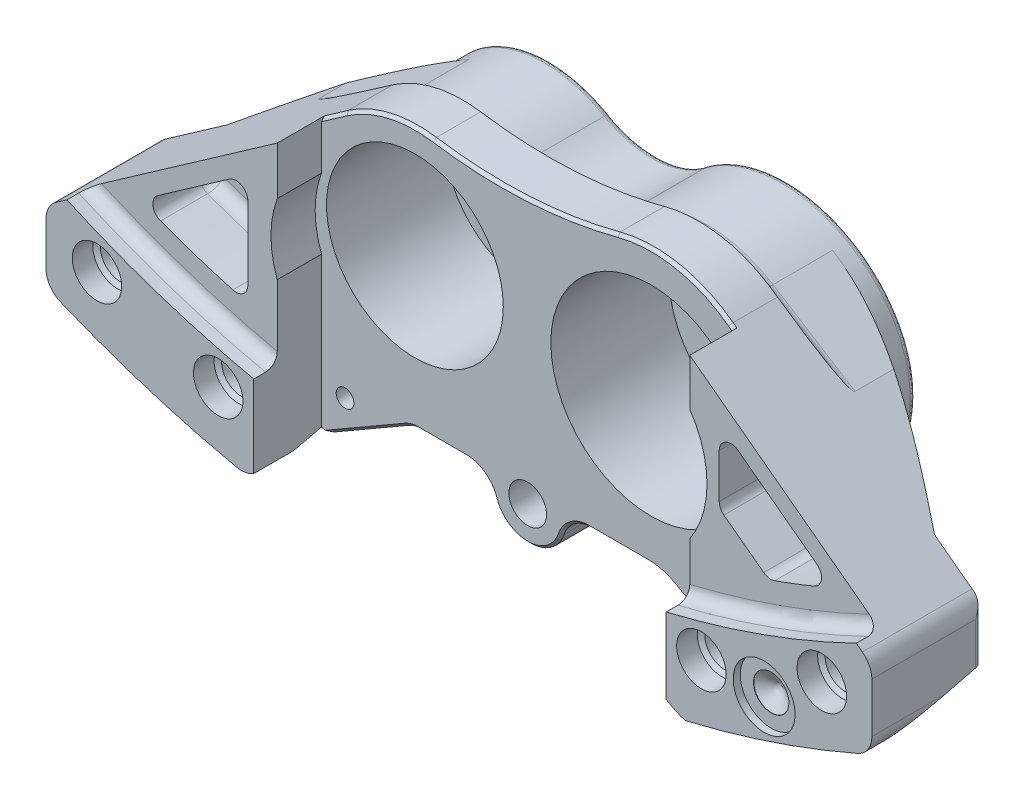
SolidWorks part; units mm, degrees
ref_plane "正面" through (0, 0, 0) normal (0, 0, 1) x (1, 0, 0)
ref_plane "平面" through (0, 0, 0) normal (0, 1, 0) x (1, 0, 0)
ref_plane "右側面" through (0, 0, 0) normal (1, 0, 0) x (0, 0, -1)
sketch "ｽｹｯﾁ1" plane through (0, 0, 0) normal (0, 0, 1) x (1, 0, 0)
  line L0 (-75.8685, -6.5404) -> (-113.4664, -32.8518)
  line L1 (-79.9236, -9.3782) -> (-109.7219, -30.2314) construction
  line L2 (-115.173, -43.4291) -> (-115.173, -36.129)
  line L3 (-115.173, -36.129) -> (-115.173, -43.4291) construction
  line L4 (-79.9972, -56.009) -> (-65.4945, -47.6359)
  line L5 (-63.4945, -47.1) -> (-55.3686, -47.1)
  line L7 (-70.1933, -47.1) -> (-55.3686, -47.1) construction
  line L8 (-34.4786, -47.1) -> (-24.5063, -47.1)
  line L9 (-34.4786, -47.1) -> (-18.9462, -47.1) construction
  line L10 (-20.0063, -48.3058) -> (-9, -54.6603)
  line L11 (24.9764, -42.1638) -> (24.9764, -33.7258)
  line L12 (24.9764, -42.1638) -> (24.9764, -33.7258) construction
  line L13 (-10.5622, -5.0784) -> (23.376, -30.5255)
  arc A0 (-60.9051, -3.0327) -> (-75.8685, -6.5404) centre (-64, -23.5) ccw
  arc A1 (-10.5622, -5.0784) -> (-29.7223, -1.3432) centre (-24, -23) ccw
  arc A2 (-60.9051, -3.0327) -> (-75.8685, -6.5404) centre (-64, -23.5) ccw construction
  arc A3 (-9.9236, -5.5754) -> (-29.7223, -1.3432) centre (-24, -23) ccw construction
  arc A4 (-60.9051, -3.0327) -> (-29.7223, -1.3432) centre (-49.3928, 73.1019) ccw
  arc A5 (-60.9051, -3.0327) -> (-29.7223, -1.3432) centre (-49.3928, 73.1019) ccw construction
  arc A6 (-112.7075, -47.123) -> (-82.8386, -56.4554) centre (-46.5809, 112.0542) ccw
  arc A7 (-112.7075, -47.123) -> (-82.8386, -56.4554) centre (-46.5809, 112.0542) ccw construction
  arc A8 (-39.2264, -50.5318) -> (-50.6209, -50.5318) centre (-44.9236, -48.65) cw
  arc A9 (-50.6209, -50.5318) -> (-39.2264, -50.5318) centre (-44.9236, -48.65) ccw construction
  arc A10 (22.5814, -45.8277) -> (-6.6879, -55.632) centre (-46.5809, 112.0542) cw
  arc A11 (-112.7075, -47.123) -> (-115.173, -43.4291) centre (-111.173, -43.4291) cw
  arc A12 (-115.173, -36.129) -> (-113.4664, -32.8518) centre (-111.173, -36.129) cw
  arc A13 (-79.9972, -56.009) -> (-82.8386, -56.4554) centre (-81.9972, -52.5449) cw
  arc A14 (-6.2197, -55.5199) -> (22.5814, -45.8277) centre (-46.5809, 112.0542) ccw construction
  arc A15 (-39.2264, -50.5318) -> (-34.4786, -47.1) centre (-34.4786, -52.1) cw
  arc A16 (-50.6209, -50.5318) -> (-55.3686, -47.1) centre (-55.3686, -52.1) ccw
  arc A17 (-65.4945, -47.6359) -> (-63.4945, -47.1) centre (-63.4945, -51.1) cw
  arc A18 (-20.0063, -48.3058) -> (-24.5063, -47.1) centre (-24.5063, -56.1) ccw
  arc A19 (24.9764, -33.7258) -> (23.376, -30.5255) centre (20.9764, -33.7258) ccw
  arc A20 (-50.6209, -50.5318) -> (-55.3686, -47.1) centre (-55.3686, -52.1) ccw construction
  arc A21 (-34.4786, -47.1) -> (-39.2264, -50.5318) centre (-34.4786, -52.1) ccw construction
  arc A22 (22.5814, -45.8277) -> (24.9764, -42.1638) centre (20.9764, -42.1638) ccw
  arc A24 (-115.173, -43.4291) -> (-112.7075, -47.123) centre (-111.173, -43.4291) ccw construction
  arc A25 (-113.4664, -32.8518) -> (-115.173, -36.129) centre (-111.173, -36.129) ccw construction
  arc A26 (-82.8386, -56.4554) -> (-79.9236, -55.9655) centre (-81.9972, -52.5449) ccw construction
  arc A29 (-6.6879, -55.632) -> (-9, -54.6603) centre (-4, -46) cw
  arc A30 (-9.9236, -54.0567) -> (-6.9316, -55.5606) centre (-4, -46) ccw construction
  arc A31 (24.9764, -33.7258) -> (22.074, -29.8793) centre (20.9764, -33.7258) ccw construction
  arc A32 (22.5814, -45.8277) -> (24.9764, -42.1638) centre (20.9764, -42.1638) ccw construction
  point P72 (-22.0947, -47.1)
  point P91 (-81.3229, -56.7744)
  point P98 (-7.1341, -55.7375)
  dimension "D5" = 4
  dimension "D6" = 30
  dimension "D7" = 9
  dimension "D2" = 30
extrude "ﾎﾞｽ - 押し出し1" add sketch "ｽｹｯﾁ1" against normal blind 18.6
sketch "ｽｹｯﾁ2" plane through (0, 0, 0) normal (0, 0, 1) x (1, 0, 0)
  line L0 (-9.9236, -41.2914) -> (-9.9236, -54.0567) construction
  line L1 (-9.9236, -63.7397) -> (-79.9236, -63.7397)
  line L2 (-9.9236, -63.7397) -> (-9.9236, 10.8058)
  line L3 (-9.9236, 10.8058) -> (-79.9236, 10.8058)
  line L4 (-79.9236, -63.7397) -> (-79.9236, 10.8058)
  line L5 (-79.9236, -55.9655) -> (-79.9236, -42.0461) construction
extrude "ｶｯﾄ - 押し出し1" cut sketch "ｽｹｯﾁ2" against normal blind 11.5
sketch "ｽｹｯﾁ3" plane through (0, 0, 0) normal (0, 0, 1) x (1, 0, 0)
  line L2 (46.3295, -15.3282) -> (46.3295, 24.83)
  line L3 (46.3295, 24.83) -> (-131.1636, 24.83)
  line L4 (-131.1636, 24.83) -> (-131.1636, -21.0037)
  arc A0 (46.3295, -15.3282) -> (-131.1636, -21.0037) centre (-46.5809, 112.0542) cw
  arc A1 (-9.9236, -41.2914) -> (22.074, -29.8793) centre (-46.5809, 112.0542) ccw construction
extrude "ｶｯﾄ - 押し出し2" cut sketch "ｽｹｯﾁ3" against normal blind 4
sketch "ｽｹｯﾁ4" plane through (0, 0, -4) normal (0, 0, 1) x (1, 0, 0)
  circle A0 centre (-24, -23) radius 17
  circle A1 centre (-64, -23.5) radius 17
  arc A2 (-9.9236, -13.4682) -> (-9.9236, -32.5318) centre (-24, -23) ccw construction
  arc A5 (-79.9236, -17.547) -> (-79.9236, -29.453) centre (-64, -23.5) ccw construction
extrude "ｶｯﾄ - 押し出し3" cut sketch "ｽｹｯﾁ4" against normal up to surface (7.5 mm away)
sketch "ｽｹｯﾁ5" plane through (0, 0, -4) normal (0, 0, 1) x (1, 0, 0)
  line L0 (14.4268, -27.565) -> (-4.9236, -13.0559)
  line L1 (22.3414, -29.7497) -> (-9.9236, -5.5572) construction
  line L2 (-4.9236, -25.5547) -> (-4.9236, -13.0559)
  line L3 (-9.9236, -13.4682) -> (-9.9236, -5.5572) construction
  line L4 (3.4777, -31.8541) -> (-4.9236, -25.5547)
  line L5 (-84.9236, -35.4087) -> (-84.9236, -16.5389)
  line L6 (-84.9236, -16.5389) -> (-103.2661, -29.3751)
  line L7 (-79.9236, -9.3782) -> (-111.6309, -31.5673) construction
  line L8 (-79.9236, -9.3782) -> (-79.9236, -17.547) construction
  arc A0 (3.4777, -31.8541) -> (14.4268, -27.565) centre (-46.5809, 112.0542) ccw
  arc A1 (-9.9236, -41.2914) -> (22.3414, -29.7497) centre (-46.5809, 112.0542) ccw construction
  arc A2 (-6.6879, -55.632) -> (22.5814, -45.8277) centre (-46.5809, 112.0542) ccw construction
  arc A3 (-103.2661, -29.3751) -> (-84.9236, -35.4087) centre (-46.5809, 112.0542) ccw
  arc A5 (-111.6309, -31.5673) -> (-79.9236, -42.0461) centre (-46.5809, 112.0542) ccw construction
  arc A6 (-112.7075, -47.123) -> (-82.8386, -56.4554) centre (-46.5809, 112.0542) ccw construction
  dimension "D2" = 20
  dimension "D5" = 20
  dimension "D1" = 3
  dimension "D3" = 5
  dimension "D4" = 10
  dimension "D6" = 5
  dimension "D7" = 3
extrude "ｶｯﾄ - 押し出し4" cut sketch "ｽｹｯﾁ5" against normal blind 10
fillet "ﾌｨﾚｯﾄ1" radius 2 14 edges at (-4.9236, -25.5547, -9) (3.4777, -31.8541, -9) (-4.9236, -19.3053, -14) (4.7516, -20.3104, -14) (8.9936, -29.8152, -14) (-0.723, -28.7044, -14) (-94.1905, -32.6828, -14) (-94.0948, -22.957, -14) (-84.9236, -25.9738, -14) (-84.9236, -16.5389, -9) (-103.2661, -29.3751, -9) (-84.9236, -35.4087, -9) (-4.9236, -13.0559, -9) (14.4268, -27.565, -9)
sketch "ｽｹｯﾁ6" plane through (0, 0, -18.6) normal (0, 0, -1) x (-1, 0, 0)
  arc A0 (53.5788, -39.5065) -> (53.9822, -7.238) centre (64, -23.5) ccw
  arc A1 (36.9258, -6.3227) -> (36.5049, -39.9952) centre (24, -23) ccw
  arc A3 (75.8685, -6.5404) -> (60.9051, -3.0327) centre (64, -23.5) ccw construction
  arc A4 (29.7223, -1.3432) -> (10.5622, -5.0784) centre (24, -23) ccw construction
  arc A5 (36.5049, -39.9952) -> (53.5788, -39.5065) centre (45.3947, -52.0771) cw
  arc A6 (36.9258, -6.3227) -> (53.9822, -7.238) centre (46.1148, 5.5332) ccw
  dimension "D1" = 42.2
  dimension "D2" = 38.2
  dimension "D3" = 15
extrude "ﾎﾞｽ - 押し出し2" add sketch "ｽｹｯﾁ6" along normal blind 15.7
ref_plane "平面1" through (0.2837, -22.6965, 0) normal (0.0125, -0.9999, 0) x (-0.9999, -0.0125, 0)
sketch "ｽｹｯﾁ7" plane through (0.2837, -22.6965, 0) normal (0.0125, -0.9999, 0) x (-0.9999, -0.0125, 0)
  line L0 (3.1856, 31.1) -> (3.1856, 18.6)
  line L1 (3.1856, 18.6) -> (-16.8144, 18.6)
  line L2 (-16.8144, 18.6) -> (3.1856, 31.1)
  line L3 (3.1856, 34.3) -> (3.1856, 18.6) construction
  line L4 (54.0684, 18.6) -> (37.002, 18.6) construction
  line L5 (37.002, 34.3) -> (3.1856, 34.3) construction
  dimension "D1" = 20
  dimension "D2" = 3.2
revolve "回転1" add sketch "ｽｹｯﾁ7" angle 70 about axis through (-24, -23, -34.3) along (0, 0, 1)
ref_plane "平面2" through (0.2837, -22.6965, 0) normal (-0.0125, 0.9999, 0) x (0.9999, 0.0125, 0)
sketch "ｽｹｯﾁ8" plane through (0.2837, -22.6965, 0) normal (-0.0125, 0.9999, 0) x (0.9999, 0.0125, 0)
  line L0 (-83.3887, 18.6) -> (-83.3887, 30.1)
  line L1 (-83.3887, 30.1) -> (-103.3887, 18.6)
  line L2 (-103.3887, 18.6) -> (-83.3887, 18.6)
  line L3 (-83.3887, 34.3) -> (-83.3887, 18.6) construction
  line L4 (-16.6244, 18.6) -> (-17.069, 18.6) construction
  line L5 (-54.0684, 34.3) -> (-83.3887, 34.3) construction
  dimension "D1" = 4.2
  dimension "D2" = 20
revolve "回転2" add sketch "ｽｹｯﾁ8" angle 64 about axis through (-64, -23.5, -34.3) along (0, 0, 1)
hole_wizard "Ø8.4 (8.4) 直径の穴1" positions "ｽｹｯﾁ11" profile "ｽｹｯﾁ12" hole size "Ø8.4" standard "JIS"
sketch "ｽｹｯﾁ11" plane through (0, 0, 0) normal (0, 0, 1) x (1, 0, 0)
  point P0 (16.477, -38.3805)
  point P2 (-3.9528, -45.3934)
  point P4 (-85.9528, -46.239)
  point P7 (-106.523, -39.6489)
sketch "ｽｹｯﾁ12" plane through (16.477, -38.3805, 0) normal (1, 0, 0) x (0, -1, 0)
  line L0 (0, 0) -> (0, 6.0236)
  line L1 (0, 6.0236) -> (4.2, 3.5)
  line L2 (4.2, 3.5) -> (4.2, 0)
  line L5 (4.2, 0) -> (0, 0)
  line L10 (0, 6.0236) -> (-4.2, 3.5) construction
  line L11 (0, -6.35) -> (0, 107.95) construction
  dimension "穴の直径" = 8.4
  dimension "穴の深さ" = 3.5
  dimension "ﾄﾞﾘﾙ角度" = 118
hole_wizard "M8x1.25 ねじ穴1" positions "ｽｹｯﾁ13" profile "ｽｹｯﾁ14" tap size "M8x1.25" standard "JIS"
sketch "ｽｹｯﾁ13" plane through (0, 0, 0) normal (0, 0, 1) x (1, 0, 0)
  point P0 (16.477, -38.3805)
  point P3 (-3.9528, -45.3934)
  point P6 (-85.9528, -46.239)
  point P8 (-106.523, -39.6489)
sketch "ｽｹｯﾁ14" plane through (16.477, -38.3805, 0) normal (1, 0, 0) x (0, -1, 0)
  line L0 (0, 0) -> (0, 34.3)
  line L1 (0, 34.3) -> (3.4, 34.3)
  line L2 (3.4, 34.3) -> (3.4, 0)
  line L5 (3.4, 0) -> (0, 0)
  line L11 (0, -6.35) -> (0, 107.95) construction
  dimension "次ｻｰﾌｪｽまでのねじ下穴ﾄﾞﾘﾙ直径" = 6.8
  dimension "次ｻｰﾌｪｽまでのねじ下穴ﾄﾞﾘﾙの深さ" = 34.3
sketch "ｽｹｯﾁ9" plane through (0, 0, -18.6) normal (0, 0, 1) x (1, 0, 0)
  line L0 (-12.7978, -5.1193) -> (17.0913, -23.8448)
  line L1 (-17.0318, -3.0838) -> (-17.0318, 28.6166)
  line L2 (-16.6024, -1.8568) -> (-17.0318, -3.0838) construction
  line L3 (-17.0318, 28.6166) -> (23.7549, 28.6166)
  line L4 (23.7549, 28.6166) -> (23.7549, -23.8448)
  line L5 (23.7549, -23.8448) -> (17.0913, -23.8448)
  line L6 (-10.7159, -39.3934) -> (-3.9528, -39.3934)
  line L7 (-34.4786, -47.1) -> (-24.5063, -47.1) construction
  line L8 (0.1007, -40.9697) -> (26.1334, -64.8243)
  line L9 (-11.6964, -40.1415) -> (-11.6964, -64.8243)
  line L10 (-11.6964, -64.8243) -> (26.1334, -64.8243)
  line L11 (1.128, -13.8437) -> (22.73, -30.0411) construction
  line L12 (23.376, -30.5255) -> (17.0079, -25.7506) construction
  line L13 (16.477, -38.3805) -> (22.73, -30.0411) construction
  arc A0 (-17.0318, -3.0838) -> (-12.7978, -5.1193) centre (-24, -23) cw
  arc A1 (-17.0318, -3.0838) -> (-36.9258, -6.3227) centre (-24, -23) ccw construction
  arc A2 (-10.7159, -39.3934) -> (-11.6964, -40.1415) centre (-24, -23) cw
  arc A3 (-36.5049, -39.9952) -> (-11.0921, -39.6912) centre (-24, -23) ccw construction
  arc A4 (0.1007, -40.9697) -> (-3.9528, -39.3934) centre (-3.9528, -45.3934) ccw
  arc A5 (17.0079, -25.7506) -> (-10.4268, 15.794) centre (-24, -23) ccw construction
  dimension "D1" = 6
  dimension "D2" = 137.5
  dimension "D3" = 27
extrude "ｶｯﾄ - 押し出し5" cut sketch "ｽｹｯﾁ9" against normal through all
sketch "ｽｹｯﾁ15" plane through (0, 0, -18.6) normal (0, 0, 1) x (1, 0, 0)
  line L0 (-3.5652, -10.3248) -> (18.8548, -27.1355)
  line L1 (18.8548, -27.1355) -> (22.9293, -21.7015)
  line L2 (22.9293, -21.7015) -> (4.6549, -7.9991)
  line L3 (4.6549, -7.9991) -> (-3.5652, -10.3248)
  line L4 (1.128, -13.8437) -> (17.0079, -25.7506) construction
extrude "ｶｯﾄ - 押し出し6" cut sketch "ｽｹｯﾁ15" against normal through all
sketch "ｽｹｯﾁ16" plane through (0, 0, -18.6) normal (0, 0, 1) x (1, 0, 0)
  line L0 (-73.5184, -6.9407) -> (-89.8773, -16.3439)
  line L1 (-89.8773, -16.3439) -> (-111.9986, -31.8246)
  line L2 (-111.9986, -31.8246) -> (-126.534, -11.054)
  line L3 (-126.534, -11.054) -> (-65.1336, 31.9146)
  line L4 (-65.1336, 31.9146) -> (-65.1336, -4.4337)
  line L5 (-103.0457, -25.5593) -> (-113.4664, -32.8518) construction
  line L6 (-85.9528, -40.239) -> (-73.1986, -40.239)
  line L7 (-63.4945, -47.1) -> (-55.3686, -47.1) construction
  line L8 (-90.1955, -41.9964) -> (-108.5753, -60.3762)
  line L10 (-108.5753, -60.3762) -> (-66.3276, -60.3762)
  line L11 (-66.3276, -60.3762) -> (-66.3276, -42.4577)
  arc A0 (-73.5184, -6.9407) -> (-65.1336, -4.4337) centre (-64, -23.5) cw
  arc A1 (-53.9822, -7.238) -> (-72.2877, -6.2918) centre (-64, -23.5) ccw construction
  arc A2 (-90.1955, -41.9964) -> (-85.9528, -40.239) centre (-85.9528, -46.239) cw
  arc A3 (-66.3276, -42.4577) -> (-73.1986, -40.239) centre (-64, -23.5) cw
  arc A4 (-72.1577, -40.7703) -> (-53.5788, -39.5065) centre (-64, -23.5) ccw construction
  dimension "D2" = 6
  dimension "D1" = 27
  dimension "D3" = 135
extrude "ｶｯﾄ - 押し出し7" cut sketch "ｽｹｯﾁ16" against normal through all
sketch "ｽｹｯﾁ17" plane through (0, 0, -18.6) normal (0, 0, -1) x (-1, 0, 0)
  line L0 (10.5622, -5.0784) -> (-1.128, -13.8437)
  line L1 (75.8685, -6.5404) -> (89.8773, -16.3439)
  line L2 (75.8685, -6.5404) -> (89.8773, -16.3439) construction
  line L3 (10.5622, -5.0784) -> (-1.128, -13.8437) construction
  line L4 (-1.128, -13.8437) -> (89.8773, -16.3439)
  line L5 (89.8773, -16.3439) -> (73.5184, -6.9407) construction
  arc A0 (75.8685, -6.5404) -> (60.9051, -3.0327) centre (64, -23.5) ccw
  arc A3 (75.8685, -6.5404) -> (60.9051, -3.0327) centre (64, -23.5) ccw construction
  arc A4 (29.7223, -1.3432) -> (60.9051, -3.0327) centre (49.3928, 73.1019) ccw
  arc A5 (29.7223, -1.3432) -> (60.9051, -3.0327) centre (49.3928, 73.1019) ccw construction
  arc A6 (10.5622, -5.0784) -> (29.7223, -1.3432) centre (24, -23) cw
  arc A7 (29.7223, -1.3432) -> (10.5622, -5.0784) centre (24, -23) ccw construction
extrude "ﾎﾞｽ - 押し出し3" add sketch "ｽｹｯﾁ17" along normal blind 0.9
hole_wizard "Ø6.4 (6.4) 直径の穴1" positions "ｽｹｯﾁ18" profile "ｽｹｯﾁ19" hole size "Ø6.4" standard "JIS"
sketch "ｽｹｯﾁ18" plane through (0, 0, -18.6) normal (0, 0, -1) x (-1, 0, 0)
  point P0 (44.9236, -48.65)
sketch "ｽｹｯﾁ19" plane through (-44.9236, -48.65, -18.6) normal (1, 0, 0) x (0, 1, 0)
  line L0 (0, 0) -> (0, 18.6)
  line L1 (0, 18.6) -> (3.2, 18.6)
  line L2 (3.2, 18.6) -> (3.2, 0)
  line L5 (3.2, 0) -> (0, 0)
  line L11 (0, -6.35) -> (0, 107.95) construction
  dimension "通し穴の直径" = 6.4
  dimension "通し穴の深さ" = 18.6
sketch "ｽｹｯﾁ20" plane through (0, 0, 0) normal (0, 0, 1) x (1, 0, 0)
  line L0 (6.6971, -45.4201) -> (10.3482, -49.1927) construction
  line L1 (10.3482, -49.1927) -> (11.3913, -50.2706) construction
  line L2 (1.4471, -45.4069) -> (0.2471, -45.4039) construction
  line L3 (13.0683, -40.8341) -> (10.9581, -42.353) construction
  circle A0 centre (6.6971, -45.4201) radius 5.25
  circle A1 centre (-3.9528, -45.3934) radius 4.2 construction
  circle A2 centre (16.477, -38.3805) radius 4.2 construction
  arc A3 (-6.6879, -55.632) -> (22.5814, -45.8277) centre (-46.5809, 112.0542) ccw construction
  dimension "D1" = 10.5
  dimension "D2" = 2.6
  dimension "D3" = 1.5
  dimension "D4" = 1.2
extrude "ｶｯﾄ - 押し出し8" cut sketch "ｽｹｯﾁ20" against normal blind 1.2
hole_wizard "Ø6.0 (6) 直径の穴1" positions "ｽｹｯﾁ21" profile "ｽｹｯﾁ23" hole size "Ø6.0" standard "JIS"
sketch "ｽｹｯﾁ21" plane through (0, 0, 0) normal (0, 0, 1) x (1, 0, 0)
  point P0 (6.6971, -45.4201)
sketch "ｽｹｯﾁ23" plane through (6.6971, -45.4201, 0) normal (1, 0, 0) x (0, -1, 0)
  line L0 (0, 0) -> (0, 3.0526)
  line L1 (0, 3.0526) -> (3, 1.25)
  line L2 (3, 1.25) -> (3, 0)
  line L5 (3, 0) -> (0, 0)
  line L10 (0, 3.0526) -> (-3, 1.25) construction
  line L11 (0, -6.35) -> (0, 107.95) construction
  dimension "穴の直径" = 6
  dimension "穴の深さ" = 1.25
  dimension "ﾄﾞﾘﾙ角度" = 118
sketch "ｽｹｯﾁ24" plane through (0, 0, -11.5) normal (0, 0, 1) x (1, 0, 0)
  circle A0 centre (-24, -23) radius 17
  circle A1 centre (-64.0695, -21.7684) radius 15
  arc A3 (-10.5622, -5.0784) -> (-29.7223, -1.3432) centre (-24, -23) ccw construction
  dimension "D1" = 34
  dimension "D2" = 30
extrude "ｶｯﾄ - 押し出し9" cut sketch "ｽｹｯﾁ24" against normal blind 20
hole_wizard "Ø3.0 (3) 直径の穴1" positions "ｽｹｯﾁ25" profile "ｽｹｯﾁ26" hole size "Ø3.0" standard "JIS"
sketch "ｽｹｯﾁ25" plane through (0, 0, -11.5) normal (0, 0, 1) x (1, 0, 0)
  line L0 (-9.9236, -54.127) -> (-9.9236, -32.5318) construction
  line L1 (-79.9236, -29.453) -> (-79.9236, -55.9665) construction
  line L2 (-24.5063, -47.1) -> (-34.4786, -47.1) construction
  line L3 (-55.3686, -47.1) -> (-63.4945, -47.1) construction
  point P0 (-13.9236, -48.6)
  point P2 (-75.9236, -48.6)
  dimension "D1" = 4
  dimension "D2" = 4
  dimension "D3" = 1.5
  dimension "D4" = 1.5
sketch "ｽｹｯﾁ26" plane through (-13.9236, -48.6, -11.5) normal (1, 0, 0) x (0, -1, 0)
  line L0 (0, 0) -> (0, 22.8)
  line L1 (0, 22.8) -> (1.5, 22.8)
  line L2 (1.5, 22.8) -> (1.5, 0)
  line L5 (1.5, 0) -> (0, 0)
  line L11 (0, -6.35) -> (0, 107.95) construction
  dimension "通し穴の直径" = 3
  dimension "通し穴の深さ" = 22.8
ref_plane "平面3" through (-10.6649, -28.0671, 0) normal (-0.3552, -0.9348, 0) x (-0.9348, 0.3552, 0)
sketch "ｽｹｯﾁ27" plane through (-10.6649, -28.0671, 0) normal (-0.3552, -0.9348, 0) x (-0.9348, 0.3552, 0)
  line L0 (-29.0354, 23) -> (-12.8347, 23)
  line L1 (-29.0354, 23) -> (-29.0354, 27)
  line L2 (-29.0354, 27) -> (-8.8347, 27)
  line L3 (-31.4516, 0) -> (-5.3903, 0) construction
  line L4 (-29.0354, 18.6) -> (-29.0354, 3.9807) construction
  line L5 (-6.8347, 34.3) -> (-6.8347, 31.1) construction
  arc A0 (-8.8347, 27) -> (-12.8347, 23) centre (-12.8347, 27) cw
  dimension "D1" = 4
  dimension "D2" = 23
  dimension "D3" = 2
revolve "ｶｯﾄ - 回転1" cut sketch "ｽｹｯﾁ27" angle 360 about L2
ref_plane "平面4" through (-1.866, 4.4304, 0) normal (0.3882, -0.9216, 0) x (-0.9216, -0.3882, 0)
sketch "ｽｹｯﾁ28" plane through (-1.866, 4.4304, 0) normal (0.3882, -0.9216, 0) x (-0.9216, -0.3882, 0)
  line L0 (113.5609, 23) -> (113.5609, 27)
  line L1 (113.5609, 27) -> (90.2037, 27)
  line L2 (113.5609, 23) -> (94.2037, 23)
  line L3 (113.5609, 18.6) -> (113.5609, 3.9807) construction
  line L5 (89.9775, 0) -> (115.1314, 0) construction
  line L6 (87.2037, 30.1) -> (87.2037, 34.3) construction
  arc A0 (90.2037, 27) -> (94.2037, 23) centre (94.2037, 27) ccw
  dimension "D1" = 4
  dimension "D2" = 23
  dimension "D3" = 3
revolve "ｶｯﾄ - 回転2" cut sketch "ｽｹｯﾁ28" angle 360 about L1
ref_plane "平面5" through (-78.5871, 31.0519, 0) normal (0.93, -0.3675, 0) x (0, 0, -1)
sketch "ｽｹｯﾁ29" plane through (-78.5871, 31.0519, 0) normal (0.93, -0.3675, 0) x (0, 0, -1)
  line L0 (2, -85.2699) -> (22, -80.7518)
  line L1 (22, -80.7518) -> (22, -85.2699)
  line L2 (22, -85.2699) -> (2, -85.2699)
  line L3 (0, -85.2699) -> (18.6, -85.2699) construction
  line L4 (0, -82.9469) -> (0, -85.2699) construction
  line L8 (18.6, -78.8964) -> (18.6, -81.5199) construction
  line L9 (18.6, -51.8162) -> (18.6, -48.8162) construction
  line L10 (18.6, -76.0199) -> (3.9807, -76.0199) construction
  dimension "D1" = 2
  dimension "D2" = 5.5
  dimension "D3" = 20
revolve "ｶｯﾄ - 回転3" cut sketch "ｽｹｯﾁ29" angle 360 about axis through (-46.5809, 112.0542, -18.6) along (0, 0, 1)
fillet "ﾌｨﾚｯﾄ2" radius 2 2 edges at (6.5234, -36.3997, -4) (-96.0555, -37.6485, -4)
fillet "ﾌｨﾚｯﾄ3" radius 1.5 5 edges at (-5.8349, -9.4815, -19.5) (-25.0511, -1.9262, -19.5) (-45.311, -9.4452, -19.5) (-63.7094, -4.4022, -19.5) (-81.6979, -11.6423, -19.5)
fillet "ﾌｨﾚｯﾄ4" radius 6 2 edges at (-10.7159, -39.3934, -24.85) (-73.1986, -40.239, -24.35)
fillet "ﾌｨﾚｯﾄ5" radius 1.5 11 edges at (3.7621, -44.3248, -18.6) (-1.7782, -39.8013, -18.6) (-6.3451, -39.3934, -18.6) (-10.5055, -39.6598, -18.6) (-24.3808, -44.0966, -18.6) (-44.9655, -37.0833, -18.6) (-62.6649, -42.5533, -18.6) (-73.3264, -40.3818, -18.6) (-80.2902, -40.239, -18.6) (-92.7118, -44.5127, -18.6) (-88.2489, -40.6958, -18.6)
sketch "ｽｹｯﾁ30" plane through (0, 0, -34.3) normal (0, 0, -1) x (-1, 0, 0)
  line L0 (30.888, -29.1744) -> (6.5579, -30.7836) construction
  line L1 (35.0493, -32.757) -> (33.6001, -30.5311) construction
  line L2 (67.55, -30.0028) -> (59.0469, -29.2265) construction
  line L3 (52.2339, -34.3038) -> (37.5259, -34.1199) construction
  line L4 (56.2281, -30.6273) -> (54.8174, -32.8908) construction
  line L5 (30.888, -29.1744) -> (4.4442, -30.9233)
  line L6 (35.0493, -32.757) -> (33.6001, -30.5311)
  line L7 (81.4474, -31.2715) -> (59.0469, -29.2265)
  line L8 (52.2339, -34.3038) -> (37.5259, -34.1199)
  line L9 (56.2281, -30.6273) -> (54.8174, -32.8908)
  arc A0 (59.0469, -29.2265) -> (56.2281, -30.6273) centre (58.7741, -32.2141) ccw construction
  arc A1 (33.6001, -30.5311) -> (30.888, -29.1744) centre (31.086, -32.1679) ccw construction
  arc A2 (35.0493, -32.757) -> (37.5259, -34.1199) centre (37.5634, -31.1202) ccw construction
  arc A3 (52.2339, -34.3038) -> (54.8174, -32.8908) centre (52.2714, -31.304) ccw construction
  arc A4 (59.0469, -29.2265) -> (56.2281, -30.6273) centre (58.7741, -32.2141) ccw
  arc A5 (33.6001, -30.5311) -> (30.888, -29.1744) centre (31.086, -32.1679) ccw
  arc A6 (35.0493, -32.757) -> (37.5259, -34.1199) centre (37.5634, -31.1202) ccw
  arc A7 (52.2339, -34.3038) -> (54.8174, -32.8908) centre (52.2714, -31.304) ccw
  arc A8 (81.4474, -31.2715) -> (53.9822, -7.238) centre (64, -23.5) ccw
  arc A9 (36.9258, -6.3227) -> (53.9822, -7.238) centre (46.1148, 5.5332) ccw
  arc A10 (36.9258, -6.3227) -> (4.4442, -30.9233) centre (24, -23) ccw
  arc A11 (36.9258, -6.3227) -> (36.5049, -39.9952) centre (24, -23) ccw construction
  arc A12 (36.9258, -6.3227) -> (53.9822, -7.238) centre (46.1148, 5.5332) ccw construction
  arc A13 (53.5788, -39.5065) -> (53.9822, -7.238) centre (64, -23.5) ccw construction
extrude "ﾎﾞｽ - 押し出し4" add sketch "ｽｹｯﾁ30" along normal blind 1
ref_plane "平面6" through (-46.0897, -0.2017, 0) normal (-1, -0.0044, 0) x (0, 0, 1)
sketch "ｽｹｯﾁ32" plane through (-46.0897, -0.2017, 0) normal (-1, -0.0044, 0) x (0, 0, 1)
  line L0 (-29.7379, 112.2569) -> (-35.3, -26.7948)
  line L1 (-35.3, -26.7948) -> (-35.3, 112.2569)
  line L2 (-35.3, 112.2569) -> (-29.7379, 112.2569)
  line L3 (-35.3, -28.9566) -> (-35.3, -30.381) construction
  line L4 (-12, 112.2569) -> (-4, 112.2569) construction
  line L5 (-34.3, -1.7948) -> (-34.3, -8.5425) construction
  line L6 (-34.3, -30.9036) -> (-34.3, -29.039) construction
  line L7 (-21, -1.7948) -> (-35.3, -1.7948) construction
  line L10 (-21, -1.7948) -> (-35.3, -1.7948) construction
  dimension "D1" = 25
chamfer "面取り1" distance 1 angle 45 9 edges at (-17.6661, -30.0489, -34.3) (-32.4281, -29.4848, -34.3) (-34.3247, -31.644, -34.3) (-36.117, -33.7485, -34.3) (-44.8799, -34.2119, -34.3) (-53.711, -33.9361, -34.3) (-55.5228, -31.7591, -34.3) (-57.439, -29.5276, -34.3) (-70.2472, -30.249, -34.3)
sketch "ｽｹｯﾁ31" plane through (0, -47.1, 0) normal (0, -1, 0) x (1, 0, 0)
  line L0 (-83.1, -35.3) -> (-66.6, -35.3)
  line L1 (-66.6, -35.3) -> (-83.1, -34.3)
  line L2 (-83.1, -34.3) -> (-83.1, -35.3)
  line L3 (-59.0469, -35.3) -> (-56.2281, -35.3) construction
  line L4 (-83.1, -30.1) -> (-83.1, -35.3) construction
  line L5 (-32.762, -34.3) -> (-30.954, -34.3) construction
  dimension "D1" = 16.5
extrude "ｶｯﾄ - 押し出し10" cut sketch "ｽｹｯﾁ31" against normal through all and the other way through all
revolve "ｶｯﾄ - 回転4" cut sketch "ｽｹｯﾁ32" angle 360 about L2
fillet "ﾌｨﾚｯﾄ6" radius 1 9 edges at (-70.9289, -50.7734, -18.6) (-64.5298, -47.2363, -18.6) (-59.4316, -47.1, -18.6) (-52.4395, -48.0478, -18.6) (-44.9236, -54.65, -18.6) (-37.4077, -48.0478, -18.6) (-29.4925, -47.1, -18.6) (-22.1769, -47.4067, -18.6) (-15.9716, -50.6352, -18.6)
fillet "ﾌｨﾚｯﾄ7" radius 1 2 edges at (-115.173, -39.0545, -18.6) (24.9764, -37.1755, -18.6)
fillet "ﾌｨﾚｯﾄ8" radius 1 3 edges at (-65.8496, -4.4898, -34.463) (-46.3413, -9.465, -34.5987) (-15.4583, -3.7062, -34.5328)
fillet "ﾌｨﾚｯﾄ9" radius 1.5 3 edges at (-18.768, -43.441, -34.3) (-44.9655, -37.0833, -34.3) (-68.8989, -41.9611, -34.3)
chamfer "面取り2" distance 0.5 angle 45 14 edges at (-77.8961, -7.9593, -11.5) (-10.2429, -5.3178, -11.5) (-68.7244, -3.3463, -11.5) (-19.714, -1.0139, -11.5) (-45.2272, -3.7854, -11.5) (-71.9985, -51.3909, -11.5) (-64.5298, -47.2363, -11.5) (-59.4316, -47.1, -11.5) (-52.4395, -48.0478, -11.5) (-44.9236, -54.65, -11.5) (-37.4077, -48.0478, -11.5) (-29.4925, -47.1, -11.5) (-22.1769, -47.4067, -11.5) (-14.965, -51.2164, -11.5)
